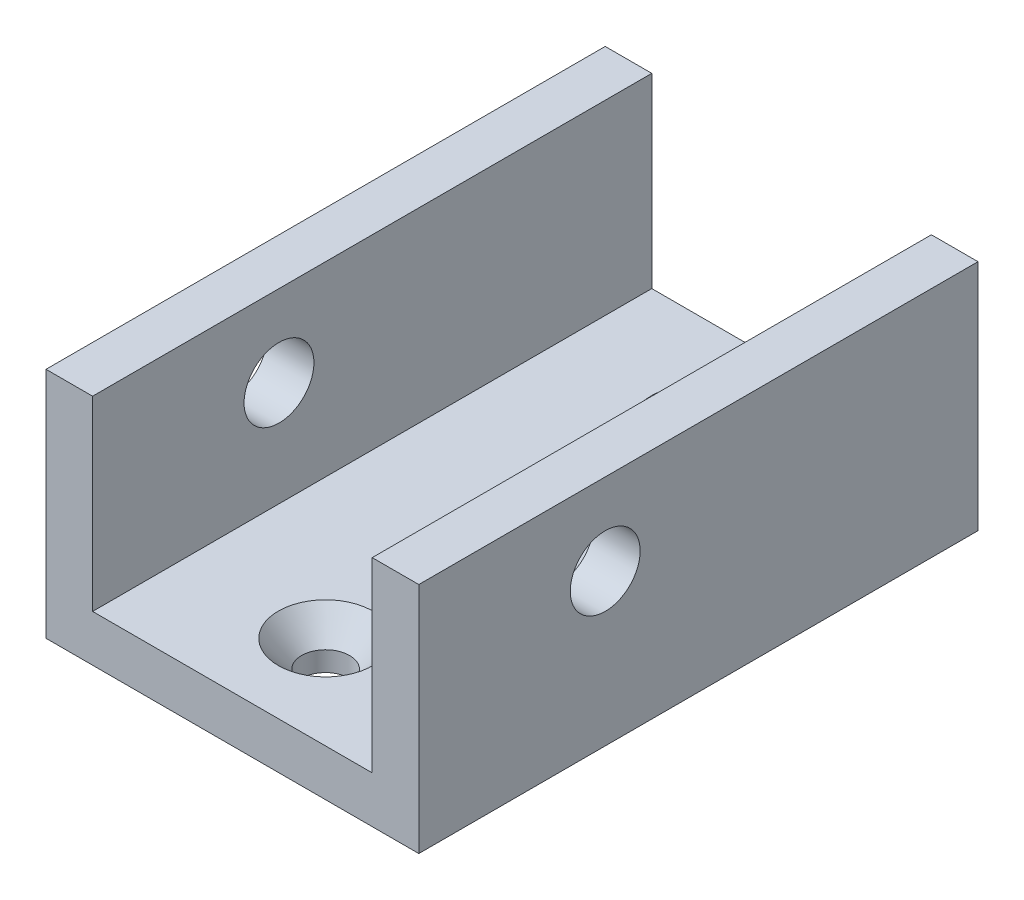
SolidWorks part; units mm, degrees
ref_plane "Front" through (0, 0, 0) normal (0, 0, 1) x (1, 0, 0)
ref_plane "Top" through (0, 0, 0) normal (0, 1, 0) x (1, 0, 0)
ref_plane "Right" through (0, 0, 0) normal (1, 0, 0) x (0, 0, -1)
sketch "Sketch1" plane through (0, 0, 0) normal (0, 0, 1) x (1, 0, 0)
  line L0 (25.4, 0) -> (-25.4, 0)
  line L1 (-25.4, 0) -> (-25.4, 31.75)
  line L2 (-25.4, 31.75) -> (-19.05, 31.75)
  line L3 (-19.05, 31.75) -> (-19.05, 6.35)
  line L4 (-19.05, 6.35) -> (19.05, 6.35)
  line L5 (0, 6.35) -> (0, 0) construction
  line L6 (19.05, 31.75) -> (19.05, 6.35)
  line L7 (25.4, 31.75) -> (19.05, 31.75)
  line L8 (25.4, 0) -> (25.4, 31.75)
  dimension "D1" = 50.8
  dimension "D2" = 38.1
  dimension "D3" = 6.35
  dimension "D4" = 6.35
  dimension "D5" = 31.75
extrude "Boss-Extrude1" add sketch "Sketch1" along normal mid plane 76.2
hole_wizard "3/8 (0.375) Diameter Hole1" positions "Sketch2" profile "Sketch3" hole size "3/8" standard "ANSI Inch"
sketch "Sketch2" plane through (25.4, 0, 0) normal (1, 0, 0) x (0, 0, -1)
  line L0 (-38.1, 0) -> (38.1, 0) construction
  line L1 (-38.1, 0) -> (-38.1, 31.75) construction
  point P0 (-12.7, 20.6375)
  dimension "D1" = 20.6375
  dimension "D2" = 25.4
sketch "Sketch3" plane through (25.4, 20.6375, 12.7) normal (0, 1, 0) x (0, 0, -1)
  line L0 (0, 0) -> (0, 50.8)
  line L1 (0, 50.8) -> (4.7625, 50.8)
  line L2 (4.7625, 50.8) -> (4.7625, 0)
  line L5 (4.7625, 0) -> (0, 0)
  line L11 (0, -6.35) -> (0, 107.95) construction
  dimension "Thru Hole Dia." = 9.525
  dimension "Thru Hole Depth" = 50.8
hole_wizard "CSK for #10 Flat Head Machine Screw1" positions "Sketch4" profile "Sketch5" countersink size "#10" standard "ANSI Inch"
sketch "Sketch4" plane through (0, 6.35, 0) normal (0, 1, 0) x (1, 0, 0)
  line L0 (0, 0) -> (0, 38.1) construction
  line L1 (19.05, 38.1) -> (-19.05, 38.1) construction
  line L2 (0, 0) -> (-25.4, 0) construction
  line L3 (-25.4, -38.1) -> (-25.4, 38.1) construction
  point P0 (-12.7, 25.4)
  point P14 (12.7, 25.4)
  point P15 (12.7, -25.4)
  point P16 (-12.7, -25.4)
  dimension "D1" = 12.7
  dimension "D2" = 25.4
sketch "Sketch5" plane through (-12.7, 6.35, -25.4) normal (1, 0, 0) x (0, 0, 1)
  line L0 (0, 0) -> (0, 6.35)
  line L1 (0, 6.35) -> (2.4892, 6.35)
  line L2 (2.4892, 6.35) -> (2.4892, 4.0312)
  line L3 (2.4892, 4.0312) -> (4.8895, 1.27)
  line L4 (4.8895, 1.27) -> (4.8895, 0)
  line L6 (4.8895, 0) -> (0, 0)
  line L7 (-2.4892, 4.0312) -> (-4.8895, 1.27) construction
  line L11 (0, -6.35) -> (0, 107.95) construction
  dimension "Thru Hole Dia." = 4.9784
  dimension "Thru Hole Depth" = 6.35
  dimension "C'Sink Dia." = 9.779
  dimension "C'Sink Angle" = 82
  dimension "Head Clearance" = 1.27
hole_wizard "CSK for 1/4 Flat Head Machine Screw1" positions "Sketch6" profile "Sketch7" countersink size "1/4" standard "ANSI Inch"
sketch "Sketch6" plane through (0, 6.35, 0) normal (0, 1, 0) x (1, 0, 0)
  point P0 (0, 25.4)
  point P2 (0, -25.4)
  dimension "D1" = 50.8
  dimension "D2" = 25.4
sketch "Sketch7" plane through (0, 6.35, -25.4) normal (1, 0, 0) x (0, 0, 1)
  line L0 (0, 0) -> (0, 6.35)
  line L1 (0, 6.35) -> (3.2639, 6.35)
  line L2 (3.2639, 6.35) -> (3.2639, 3.6524)
  line L3 (3.2639, 3.6524) -> (6.4389, 0)
  line L5 (6.4389, 0) -> (0, 0)
  line L6 (-3.2639, 3.6524) -> (-6.4389, 0) construction
  line L11 (0, -6.35) -> (0, 107.95) construction
  dimension "Thru Hole Dia." = 6.5278
  dimension "Thru Hole Depth" = 6.35
  dimension "Near C'Sink Dia." = 12.8778
  dimension "Near C'Sink Angle" = 82
